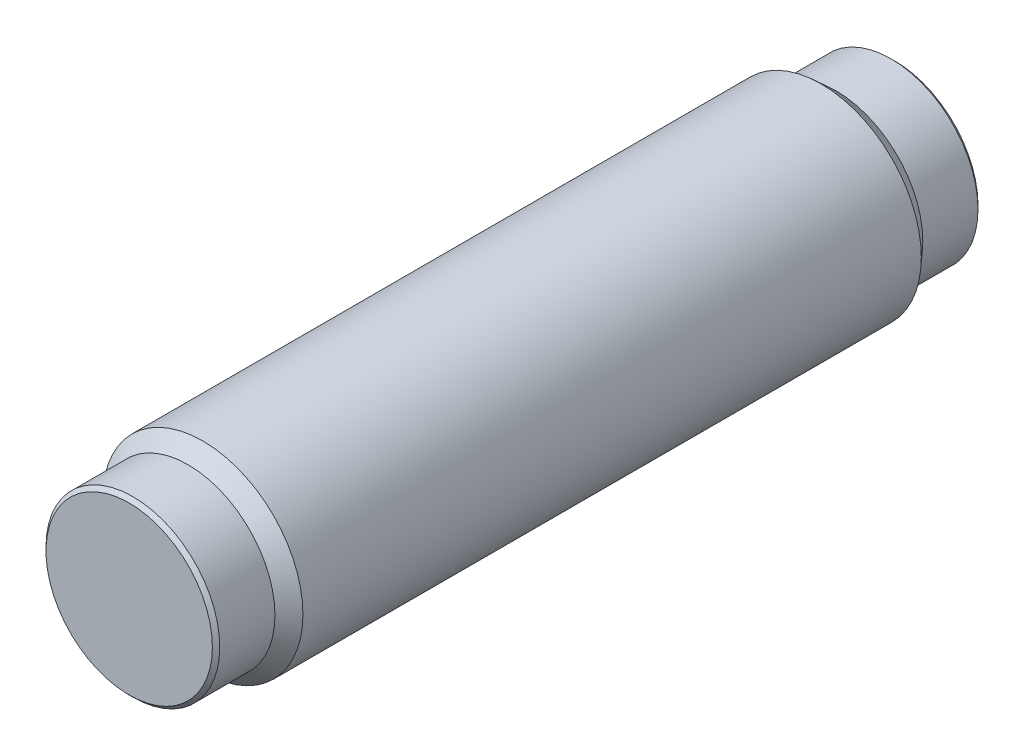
SolidWorks part; units mm, degrees
ref_plane "Front Plane" through (0, 0, 0) normal (0, 0, 1) x (1, 0, 0)
ref_plane "Top Plane" through (0, 0, 0) normal (0, 1, 0) x (1, 0, 0)
ref_plane "Right Plane" through (0, 0, 0) normal (1, 0, 0) x (0, 0, -1)
sketch "Sketch1" plane through (0, 0, 0) normal (0, 0, 1) x (1, 0, 0)
  circle A0 centre (0, 0) radius 3.4
  dimension "D1" = 6.8
extrude "Boss-Extrude1" add sketch "Sketch1" along normal mid plane 21 contours A0
sketch "Sketch2" plane through (0, 0, 0) normal (0, 1, 0) x (1, 0, 0)
  line L0 (3.4, 10.5) -> (3.4, -10.5)
  line L1 (-3.4, -10.5) -> (-3.4, 10.5)
  line L2 (-3.4, -10.5) -> (-3.4, 10.5)
  line L3 (3.4, 10.5) -> (3.4, -10.5)
  line L4 (0, -13) -> (0, 13) construction
  line L5 (0, 13) -> (2.95, 13)
  line L6 (2.95, 13) -> (2.95, 11)
  line L7 (2.95, 11) -> (3.4, 10.5)
  line L8 (3.4, 10.5) -> (-3.4, 10.5) construction
  line L9 (0, 13) -> (0, 10.5)
  line L10 (0, 10.5) -> (3.4, 10.5)
  line L11 (0, -13) -> (2.95, -13)
  line L12 (2.95, -13) -> (2.95, -11)
  line L13 (2.95, -11) -> (3.4, -10.5)
  line L14 (-3.4, -10.5) -> (3.4, -10.5) construction
  line L15 (0, -13) -> (0, -10.5)
  line L16 (0, -10.5) -> (3.4, -10.5)
  point P8 (0, 0)
  dimension "D1" = 26
  dimension "D2" = 2.95
  dimension "D3" = 0.5
  dimension "D4" = 2.95
  dimension "D5" = 0.5
revolve "Revolve1" add sketch "Sketch2" angle 360 about L4
chamfer "Chamfer1" distance 0.125 angle 45 2 edges at (2.95, 0, 13) (2.95, 0, -13)
